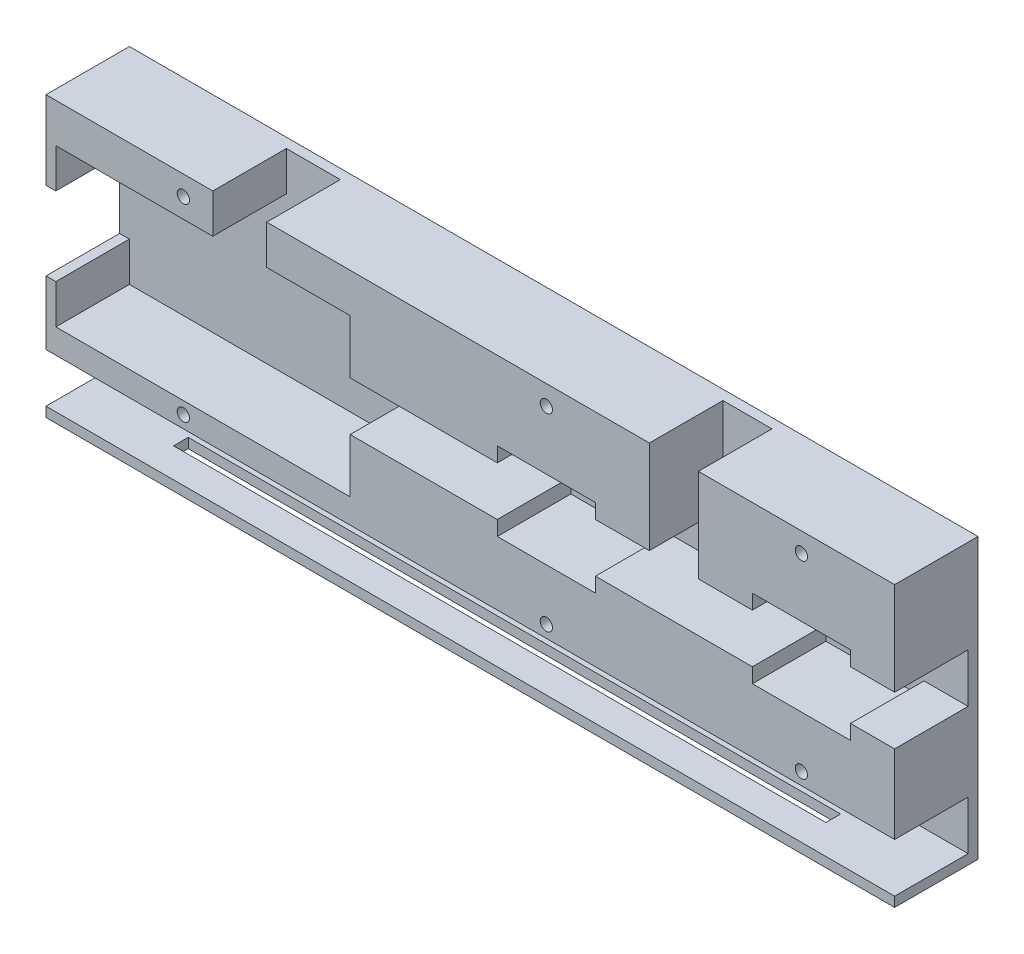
SolidWorks part; units mm, degrees
ref_plane "Front Plane" through (0, 0, 0) normal (0, 0, 1) x (1, 0, 0)
ref_plane "Top Plane" through (0, 0, 0) normal (0, 1, 0) x (1, 0, 0)
ref_plane "Right Plane" through (0, 0, 0) normal (1, 0, 0) x (0, 0, -1)
sketch "Sketch1" plane through (0, 0, 0) normal (0, 0, 1) x (1, 0, 0)
  line L0 (-16.4201, 2) -> (203.1082, 2) construction
  line L1 (0, 0) -> (173, 0)
  line L2 (0, 0) -> (0, 57)
  line L3 (0, 57) -> (173, 57)
  line L4 (173, 0) -> (173, 57)
  line L5 (-16.4201, 12) -> (203.1082, 12) construction
  line L6 (-16.4201, 17) -> (203.1082, 17) construction
  line L7 (-16.4201, 49) -> (203.1082, 49) construction
  line L8 (2, 77.0578) -> (2, -21.0109) construction
  line L9 (171, 81.3895) -> (171, -21.0109) construction
  line L10 (34, 57) -> (34, 49) construction
  line L11 (45, 57) -> (45, 49) construction
  line L12 (62, 49) -> (62, 17) construction
  line L13 (92, 65.6222) -> (92, -10.2684) construction
  line L14 (112, 66.2684) -> (112, -10.2684) construction
  line L15 (144, 66.2684) -> (144, -10.2684) construction
  line L16 (164, 65.6222) -> (164, -10.2684) construction
  line L17 (62, 38) -> (92, 38) construction
  line L18 (62, 28) -> (92, 28) construction
  line L19 (92, 41) -> (112, 41) construction
  line L20 (92, 25) -> (112, 25) construction
  line L21 (112, 38) -> (144, 38) construction
  line L22 (112, 28) -> (144, 28) construction
  line L23 (123, 57) -> (123, 38) construction
  line L24 (133, 57) -> (133, 38) construction
  line L25 (144, 41) -> (164, 41) construction
  line L26 (144, 25) -> (164, 25) construction
  line L27 (164, 38) -> (171, 38) construction
  line L28 (164, 28) -> (171, 28) construction
  line L29 (-16.4201, 41) -> (2, 41) construction
  line L30 (-16.4201, 25) -> (2, 25) construction
  line L31 (2, 49) -> (2, 41)
  line L32 (2, 41) -> (0, 41)
  line L33 (0, 41) -> (0, 57)
  line L34 (34, 57) -> (34, 49)
  line L35 (34, 49) -> (2, 49)
  line L36 (45, 57) -> (45, 49)
  line L37 (45, 49) -> (62, 49)
  line L38 (62, 49) -> (62, 38)
  line L39 (62, 38) -> (92, 38)
  line L40 (92, 38) -> (92, 41)
  line L41 (92, 41) -> (112, 41)
  line L42 (112, 41) -> (112, 38)
  line L43 (112, 38) -> (123, 38)
  line L44 (144, 38) -> (144, 41)
  line L45 (144, 41) -> (164, 41)
  line L46 (164, 41) -> (164, 38)
  line L47 (164, 38) -> (171, 38)
  line L48 (171, 38) -> (171, 28)
  line L49 (171, 49) -> (62, 49)
  line L50 (123, 38) -> (123, 57)
  line L51 (171, 57) -> (173, 57)
  line L52 (123, 57) -> (133, 57)
  line L53 (133, 57) -> (133, 38)
  line L54 (171, 28) -> (164, 28)
  line L55 (164, 28) -> (164, 25)
  line L56 (164, 25) -> (144, 25)
  line L57 (144, 25) -> (144, 28)
  line L58 (144, 28) -> (112, 28)
  line L59 (112, 28) -> (112, 25)
  line L60 (112, 25) -> (92, 25)
  line L61 (92, 25) -> (92, 28)
  line L62 (92, 28) -> (62, 28)
  line L63 (62, 28) -> (62, 17)
  line L64 (62, 17) -> (2, 17)
  line L65 (2, 17) -> (2, 25)
  line L66 (2, 25) -> (0, 25)
  line L67 (0, 25) -> (0, 17)
  line L68 (0, 17) -> (2, 17)
  line L69 (133, 38) -> (144, 38)
  line L70 (0, 2) -> (173, 2)
  line L71 (0, 12) -> (173, 12)
  dimension "D1" = 173
  dimension "D2" = 57
  dimension "D3" = 8
  dimension "D4" = 2
  dimension "D5" = 10
  dimension "D6" = 5
  dimension "D7" = 2
  dimension "D8" = 2
  dimension "D9" = 32
  dimension "D10" = 11
  dimension "D11" = 17
  dimension "D12" = 30
  dimension "D13" = 20
  dimension "D14" = 32
  dimension "D15" = 20
  dimension "D16" = 11
  dimension "D17" = 11
  dimension "D18" = 8
  dimension "D19" = 8
  dimension "D20" = 11
  dimension "D21" = 11
  dimension "D22" = 11
  dimension "D23" = 8
  dimension "D24" = 8
  dimension "D25" = 11
  dimension "D26" = 11
  dimension "D27" = 8
  dimension "D28" = 8
extrude "Boss-Extrude5" add sketch "Sketch1" along normal blind 15
sketch "Sketch4" plane through (0, 0, 0) normal (0, 0, -1) x (-1, 0, 0)
  line L1 (-173, 0) -> (0, 0)
  line L2 (-173, 0) -> (-173, 57)
  line L3 (-173, 57) -> (0, 57)
  line L4 (0, 0) -> (0, 57)
extrude "Boss-Extrude6" add sketch "Sketch4" along normal blind 2
sketch "Sketch5" plane through (0, 0, 15) normal (0, 0, 1) x (1, 0, 0)
  line L0 (28, 65.5001) -> (28, -19.1318) construction
  line L1 (102, 65.5001) -> (102, -19.1318) construction
  line L2 (154, 65.5001) -> (154, -19.1318) construction
  line L3 (0, 41) -> (0, 57) construction
  line L4 (0, 57) -> (181.354, 57) construction
  line L5 (0, 49) -> (181.354, 49) construction
  line L6 (-4.6234, 53) -> (181.354, 53) construction
  line L7 (0, 12) -> (181.354, 12) construction
  line L8 (0, 17) -> (181.354, 17) construction
  line L9 (0, 12) -> (0, 25) construction
  line L10 (-2.3442, 14.5) -> (191.838, 14.5) construction
  circle A0 centre (28, 53) radius 1.25
  circle A1 centre (28, 14.5) radius 1.25
  circle A2 centre (102, 53) radius 1.25
  circle A3 centre (102, 14.5) radius 1.25
  circle A4 centre (154, 14.5) radius 1.25
  circle A5 centre (154, 53) radius 1.25
  dimension "D7" = 2.5
  dimension "D8" = 2.5
  dimension "D9" = 2.5
  dimension "D10" = 2.5
  dimension "D11" = 2.5
  dimension "D12" = 2.5
  dimension "D1" = 28
  dimension "D2" = 74
  dimension "D3" = 52
  dimension "D4" = 4
  dimension "D5" = 5
  dimension "D6" = 2.5
extrude "Cut-Extrude1" cut sketch "Sketch5" against normal blind 17
sketch "Sketch6" plane through (0, 0, 0) normal (0, 0, 1) x (1, 0, 0)
  line L0 (0, 12) -> (177.3212, 12) construction
  line L1 (0, 2) -> (177.3212, 2) construction
  line L2 (-2.549, 7) -> (177.3212, 7) construction
  line L3 (-2.549, 9.5) -> (187.9476, 9.5) construction
  line L4 (-2.549, 4.5) -> (187.9476, 4.5) construction
  circle A0 centre (46.1707, 9.5) radius 1.25
  circle A1 centre (63.029, 4.5) radius 1.25
  circle A2 centre (99.1706, 9.5) radius 1.25
  circle A3 centre (112.5649, 4.5) radius 1.25
  circle A4 centre (161.8698, 9.5) radius 1.25
  circle A5 centre (146.2816, 4.5) radius 1.25
  dimension "D4" = 2.5
  dimension "D5" = 2.5
  dimension "D6" = 2.5
  dimension "D7" = 2.5
  dimension "D8" = 2.5
  dimension "D9" = 2.5
  dimension "D1" = 5
  dimension "D2" = 2.5
  dimension "D3" = 2.5
extrude "Cut-Extrude2" cut sketch "Sketch6" against normal blind 17
sketch "Sketch7" plane through (0, 0, 15) normal (0, 0, 1) x (1, 0, 0)
  line L0 (171, 28) -> (171, 38)
  line L1 (171, 38) -> (173, 38)
  line L2 (173, 12) -> (173, 57) construction
  line L3 (173, 38) -> (173, 28)
  line L4 (173, 28) -> (171, 28)
extrude "Cut-Extrude4" cut sketch "Sketch7" against normal blind 15
sketch "Sketch8" plane through (0, 0, 0) normal (0, -1, 0) x (1, 0, 0)
  line L0 (0, 15) -> (180.0303, 15) construction
  line L1 (0, 0) -> (180.0303, 0) construction
  line L3 (0, 7.5) -> (180.0303, 7.5) construction
  line L4 (0, 15) -> (0, -2) construction
  line L5 (173, 15) -> (173, -2) construction
  line L6 (20, 6) -> (153, 6)
  line L7 (20, 6) -> (20, 9)
  line L8 (20, 9) -> (153, 9)
  line L9 (153, 6) -> (153, 9)
  dimension "D1" = 7.5
  dimension "D2" = 20
  dimension "D3" = 20
  dimension "D4" = 6
  dimension "D5" = 6
extrude "Cut-Extrude5" cut sketch "Sketch8" against normal blind 3
